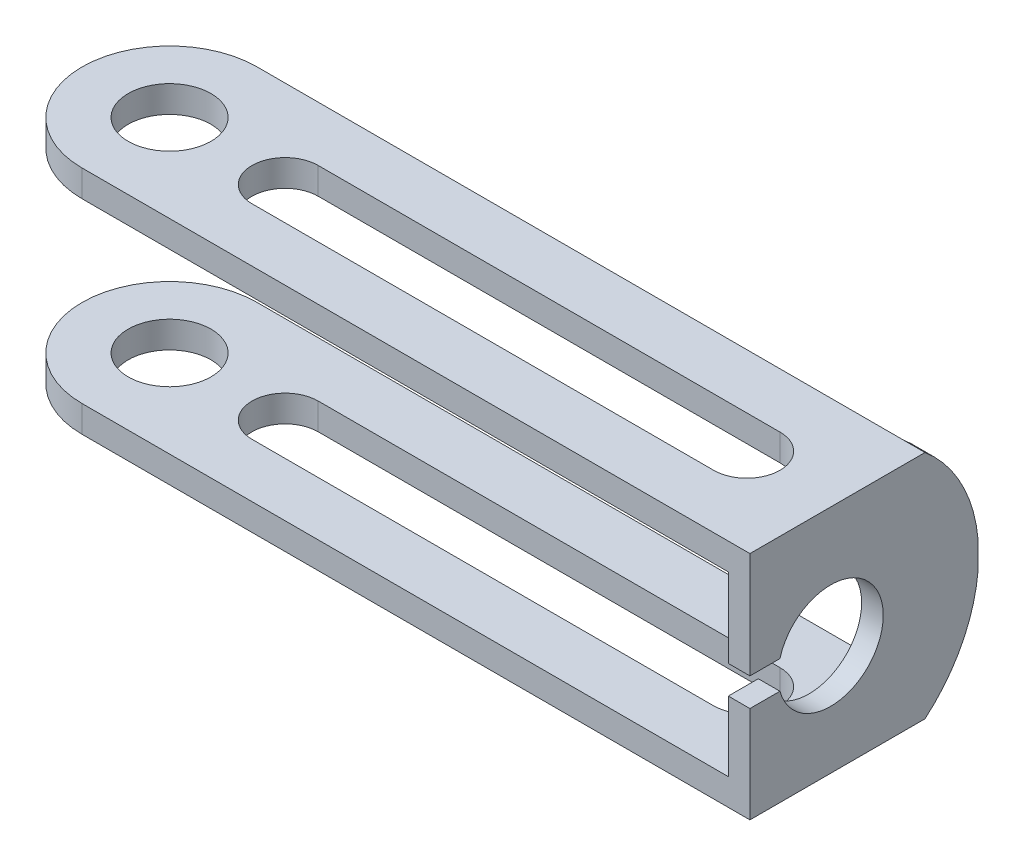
SolidWorks part; units mm, degrees
ref_plane "Plan1" through (0, 0, 0) normal (0, 0, 1) x (1, 0, 0)
ref_plane "Plan2" through (0, 0, 0) normal (0, 1, 0) x (1, 0, 0)
ref_plane "Plan3" through (0, 0, 0) normal (1, 0, 0) x (0, 0, -1)
sketch "Esquisse2" plane through (0, 0, 0) normal (0, 0, 1) x (1, 0, 0)
  line L0 (260.4457, 423.3422) -> (333.8059, 423.3422)
  line L1 (260.4457, 400.9422) -> (333.8059, 400.9422)
  line L2 (333.8059, 423.3422) -> (333.8059, 400.9422)
  line L3 (331.7059, 420.7522) -> (331.7059, 403.5322)
  line L4 (331.7059, 420.7522) -> (260.4457, 420.7522)
  line L5 (331.7059, 403.5322) -> (260.4457, 403.5322)
  line L6 (260.4457, 420.7522) -> (260.4457, 423.3422)
  line L7 (260.4457, 403.5322) -> (260.4457, 400.9422)
  line L8 (333.8059, 412.1422) -> (257.7264, 412.1422) construction
  point P7 (331.7059, 412.1422)
extrude "Base-Extrusion" add sketch "Esquisse2" along normal blind 30
sketch "Esquisse4" plane through (684.0892, 423.3422, -391.7957) normal (0, 1, 0) x (-1, 0, 0)
  line L0 (415.1431, 421.7957) -> (350.2833, 421.7957)
  line L1 (352.46, 404.7949) -> (415.1431, 404.7949)
  line L2 (350.2833, 421.7957) -> (350.2833, 399.6473)
  line L3 (352.46, 399.6473) -> (352.46, 404.7949)
  line L4 (350.2833, 399.6473) -> (352.46, 399.6473)
  arc A0 (415.1431, 421.7957) -> (415.1431, 404.7949) centre (415.1431, 413.2953) cw
extrude "Enlèv. mat.-Extru.2" cut sketch "Esquisse4" against normal blind 30 flip side to cut
sketch "Esquisse6" plane through (333.8059, 0, 0) normal (1, 0, 0) x (0, 0, -1)
  line L0 (-30, 400.9422) -> (-7.8516, 400.9422) construction
  line L1 (-30, 423.3422) -> (-7.8516, 423.3422) construction
  arc A0 (-12.9992, 400.9422) -> (-12.9992, 423.3422) centre (-22.4331, 412.1422) ccw
extrude "Enlèv. mat.-Extru.3" cut sketch "Esquisse6" against normal through all and the other way through all flip side to cut
sketch "Esquisse7" plane through (333.8059, 0, 0) normal (1, 0, 0) x (0, 0, -1)
  line L0 (-30, 411.6808) -> (-8.6777, 411.6808) construction
  line L1 (-30, 400.9422) -> (-30, 423.3422) construction
  line L2 (-27.0884, 410.3099) -> (-30, 410.3099)
  line L3 (-27.0884, 413.0518) -> (-30, 413.0518)
  line L4 (-30, 410.3099) -> (-30, 413.0518)
  arc A0 (-27.0884, 410.3099) -> (-27.0884, 413.0518) centre (-22.1646, 411.6808) ccw
extrude "Enlèv. mat.-Extru.4" cut sketch "Esquisse7" against normal blind 30
sketch "Esquisse8" plane through (0, 400.9422, 0) normal (0, -1, 0) x (1, 0, 0)
  circle A0 centre (268.9461, 21.4996) radius 4.0215
extrude "Enlèv. mat.-Extru.5" cut sketch "Esquisse8" against normal through all
sketch "Esquisse9" plane through (-121.3943, 400.9422, -390.7589) normal (0, -1, 0) x (1, 0, 0)
  line L0 (401.5998, 415.5152) -> (446.4385, 415.5152)
  line L1 (401.5998, 409.0807) -> (446.4385, 409.0807)
  arc A0 (401.5998, 415.5152) -> (401.5998, 409.0807) centre (401.5998, 412.298) ccw
  arc A1 (446.4385, 409.0807) -> (446.4385, 415.5152) centre (446.4385, 412.298) ccw
extrude "Enlèv. mat.-Extru.6" cut sketch "Esquisse9" against normal blind 30
